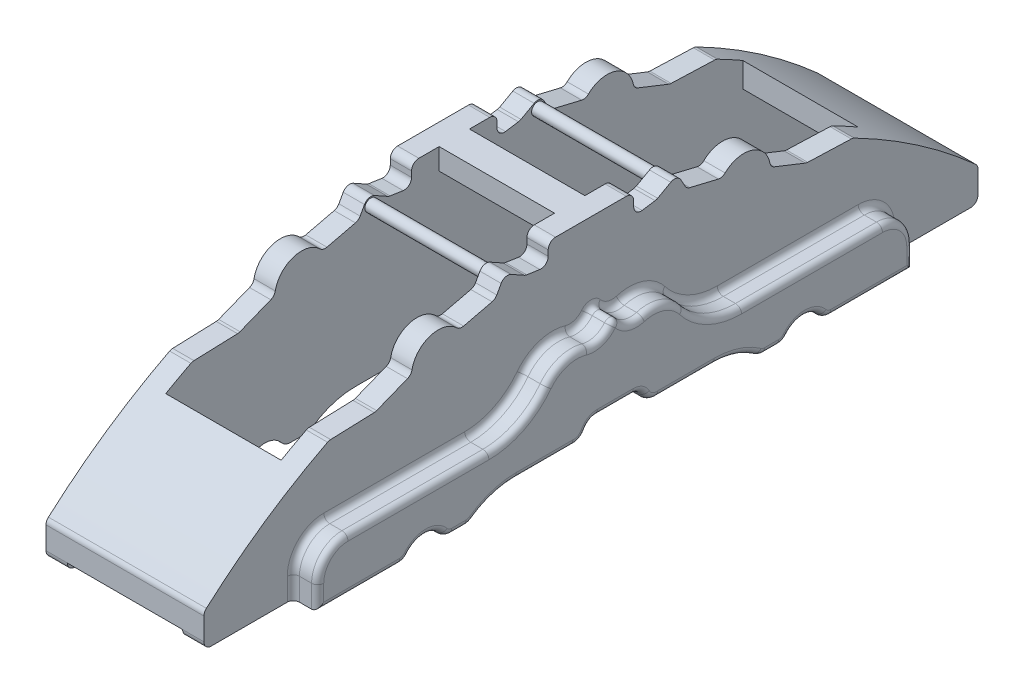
SolidWorks part; units mm, degrees
ref_plane "Front Plane" through (0, 0, 0) normal (0, 0, 1) x (1, 0, 0)
ref_plane "Top Plane" through (0, 0, 0) normal (0, 1, 0) x (1, 0, 0)
ref_plane "Right Plane" through (0, 0, 0) normal (1, 0, 0) x (0, 0, -1)
sketch "Sketch1" plane through (0, 0, 0) normal (1, 0, 0) x (0, 0, -1)
  line L0 (-95, 0) -> (-87.27, 0) construction
  line L1 (0, 166.0361) -> (0, 65.0331) construction
  line L2 (-63.7215, 65.0331) -> (58.1957, 65.0331) construction
  line L3 (0, -87.27) -> (0, -214.068) construction
  line L4 (2.939, 70.0131) -> (-2.939, 70.0131)
  line L5 (-7.0401, 67.674) -> (-16.2966, 67.674)
  line L6 (-24.5815, 65.0331) -> (-26.9166, 65.0331)
  line L7 (-35.4808, 65.0331) -> (-54.9446, 65.0331)
  line L8 (-58.1957, 65.0331) -> (-62.514, 65.0331)
  line L9 (-63.7215, 66.2407) -> (-63.7215, 69.9215)
  line L10 (-58.1957, 65.0331) -> (-57.3597, 65.0331)
  line L11 (58.1957, 65.0331) -> (57.3597, 65.0331)
  line L12 (35.4808, 65.0331) -> (58.1957, 65.0331)
  line L13 (24.5815, 65.0331) -> (26.9166, 65.0331)
  line L14 (7.0401, 67.674) -> (16.2966, 67.674)
  line L15 (5.8325, 95) -> (-5.8325, 95)
  line L16 (-7.0401, 93.7924) -> (-7.0401, 92.8759)
  line L17 (-8.4245, 91.6813) -> (-10.5682, 91.9985)
  line L18 (-10.9799, 92.1386) -> (-13.1413, 93.3449)
  line L19 (-14.7842, 92.8789) -> (-15.5027, 91.5916)
  line L20 (-16.2768, 91.0055) -> (-20.9626, 89.8872)
  line L21 (-30.2095, 87.0105) -> (-35.2872, 84.998)
  line L22 (-35.6889, 84.9139) -> (-42.8583, 84.6567)
  line L23 (63.7215, 66.2407) -> (63.7215, 69.9215)
  line L25 (35.6889, 84.9139) -> (42.8583, 84.6567)
  line L26 (30.2095, 87.0105) -> (35.2872, 84.998)
  line L27 (16.2768, 91.0055) -> (20.9626, 89.8872)
  line L28 (8.4245, 91.6813) -> (10.5682, 91.9985)
  line L29 (14.7842, 92.8789) -> (15.5027, 91.5916)
  line L30 (10.9799, 92.1386) -> (13.1413, 93.3449)
  line L31 (7.0401, 93.7924) -> (7.0401, 92.8759)
  line L34 (-57.3597, 65.0331) -> (-54.9446, 65.0331)
  line L35 (58.1957, 65.0331) -> (62.514, 65.0331)
  arc A1 (55.7155, 67.1702) -> (-55.7155, 67.1702) centre (0, 0) ccw construction
  arc A2 (-4.7152, 68.9324) -> (-7.0401, 67.674) centre (-6.8031, 70.0131) cw
  arc A3 (-16.2966, 67.674) -> (-23.4241, 65.4021) centre (-16.2966, 55.3578) ccw
  arc A4 (-28.4685, 65.7715) -> (-33.9289, 65.7715) centre (-31.1987, 63.5521) ccw
  arc A5 (-35.4808, 65.0331) -> (-33.9289, 65.7715) centre (-35.4808, 67.0331) ccw
  arc A6 (-26.9166, 65.0331) -> (-28.4685, 65.7715) centre (-26.9166, 67.0331) cw
  arc A7 (-23.4241, 65.4021) -> (-24.5815, 65.0331) centre (-24.5815, 67.0331) cw
  arc A8 (-4.7152, 68.9324) -> (-2.939, 70.0131) centre (-2.939, 68.0131) cw
  arc A9 (4.7152, 68.9324) -> (2.939, 70.0131) centre (2.939, 68.0131) ccw
  arc A10 (23.4241, 65.4021) -> (24.5815, 65.0331) centre (24.5815, 67.0331) ccw
  arc A11 (26.9166, 65.0331) -> (28.4685, 65.7715) centre (26.9166, 67.0331) ccw
  arc A12 (35.4808, 65.0331) -> (33.9289, 65.7715) centre (35.4808, 67.0331) cw
  arc A13 (28.4685, 65.7715) -> (33.9289, 65.7715) centre (31.1987, 63.5521) cw
  arc A14 (16.2966, 67.674) -> (23.4241, 65.4021) centre (16.2966, 55.3578) cw
  arc A15 (4.7152, 68.9324) -> (7.0401, 67.674) centre (6.8031, 70.0131) ccw
  arc A16 (-22.0839, 90.1952) -> (-29.4703, 87.8967) centre (-25.1511, 87.0344) ccw
  arc A17 (-43.3663, 84.5243) -> (-63.3188, 70.8218) centre (0, 0) ccw
  arc A19 (-62.514, 65.0331) -> (-63.7215, 66.2407) centre (-62.514, 66.2407) cw
  arc A20 (-63.7215, 69.9215) -> (-63.3188, 70.8218) centre (-62.514, 69.9215) cw
  arc A21 (-42.8583, 84.6567) -> (-43.3663, 84.5243) centre (-42.8151, 83.4499) ccw
  arc A22 (-35.2872, 84.998) -> (-35.6889, 84.9139) centre (-35.7322, 86.1207) cw
  arc A23 (-29.4703, 87.8967) -> (-30.2095, 87.0105) centre (-30.6545, 88.1331) cw
  arc A24 (-20.9626, 89.8872) -> (-22.0839, 90.1952) centre (-21.2429, 91.0618) cw
  arc A25 (-15.5027, 91.5916) -> (-16.2768, 91.0055) centre (-16.5572, 92.1801) cw
  arc A26 (-13.1413, 93.3449) -> (-14.7842, 92.8789) centre (-13.7298, 92.2904) ccw
  arc A27 (-10.5682, 91.9985) -> (-10.9799, 92.1386) centre (-10.3914, 93.1931) cw
  arc A28 (-7.0401, 92.8759) -> (-8.4245, 91.6813) centre (-8.2477, 92.8759) cw
  arc A29 (-5.8325, 95) -> (-7.0401, 93.7924) centre (-5.8325, 93.7924) ccw
  arc A32 (63.7215, 69.9215) -> (63.3188, 70.8218) centre (62.514, 69.9215) ccw
  arc A33 (62.514, 65.0331) -> (63.7215, 66.2407) centre (62.514, 66.2407) ccw
  arc A35 (35.2872, 84.998) -> (35.6889, 84.9139) centre (35.7322, 86.1207) ccw
  arc A36 (42.8583, 84.6567) -> (43.3663, 84.5243) centre (42.8151, 83.4499) cw
  arc A37 (43.3663, 84.5243) -> (63.3188, 70.8218) centre (0, 0) cw
  arc A38 (29.4703, 87.8967) -> (30.2095, 87.0105) centre (30.6545, 88.1331) ccw
  arc A39 (20.9626, 89.8872) -> (22.0839, 90.1952) centre (21.2429, 91.0618) ccw
  arc A40 (22.0839, 90.1952) -> (29.4703, 87.8967) centre (25.1511, 87.0344) cw
  arc A41 (15.5027, 91.5916) -> (16.2768, 91.0055) centre (16.5572, 92.1801) ccw
  arc A42 (5.8325, 95) -> (7.0401, 93.7924) centre (5.8325, 93.7924) cw
  arc A43 (7.0401, 92.8759) -> (8.4245, 91.6813) centre (8.2477, 92.8759) ccw
  arc A44 (10.5682, 91.9985) -> (10.9799, 92.1386) centre (10.3914, 93.1931) ccw
  arc A45 (13.1413, 93.3449) -> (14.7842, 92.8789) centre (13.7298, 92.2904) cw
  point P9 (23.9174, 65.0331)
  point P24 (-34.3903, 65.0331)
  point P27 (-28.0071, 65.0331)
  point P30 (-23.9174, 65.0331)
  point P54 (0, 70.0131)
  point P55 (28.0071, 65.0331)
  point P56 (34.3903, 65.0331)
  point P74 (-63.7215, 70.4597)
  point P77 (-43.1262, 84.6471)
  point P106 (63.7215, 70.4597)
  point P113 (43.1262, 84.6471)
  point P136 (0, 95)
  dimension "D2" = 87.27
  dimension "D4" = 2
  dimension "D3" = 65.0331
extrude "Boss-Extrude1" add sketch "Sketch1" along normal blind 26 contours A45 L30 A44 L28 A43 L31 A42 L15 A29 L16 A28 L17 A27 L18 A26 L19 A25 L20 A24 A16 A23 L21 A22 L22 A21 A17 A20 L9 A19 L8 L10 L34 L7 A5 A4 A6 L6 A7 A3 L5 A2 A8 L4 A9 A15 L14 A14 A10 L13 A11 A13
shell "Shell1" thickness 3.5
sketch "Sketch2" plane through (0, 0, 0) normal (0, 1, 0) x (1, 0, 0)
  line L0 (26, 0) -> (108.635, 0) construction
  line L1 (13, 63.7215) -> (13, 2.5) construction
  line L2 (26, 63.7215) -> (0, 63.7215) construction
  line L3 (26, -63.3188) -> (0, -63.3188) construction
  line L4 (26, 5.8325) -> (26, -5.8325) construction
  line L5 (3.5, 2.5) -> (22.5, 2.5)
  line L6 (0, 2.5) -> (0, -2.5)
  line L7 (3.5, -2.5) -> (22.5, -2.5)
  line L8 (26, 2.5) -> (26, -2.5)
  line L9 (13, -2.5) -> (13, -63.3188) construction
  line L11 (22.5, -2.5) -> (22.5, -47.5)
  line L13 (3.5, 2.5) -> (3.5, 47.5)
  line L14 (3.5, 47.5) -> (22.5, 47.5)
  line L15 (22.5, 2.5) -> (22.5, 47.5)
  line L16 (3.5, -2.5) -> (3.5, -47.5)
  line L17 (3.5, -47.5) -> (22.5, -47.5)
  point P9 (13, 0)
  dimension "D1" = 5
  dimension "D2" = 45
  dimension "D3" = 19
extrude "Cut-Extrude1" cut sketch "Sketch2" along normal through all contours L5 L15 L14 L13 | L16 L17 L11 L7
sketch "Sketch3" plane through (26, 0, 0) normal (1, 0, 0) x (0, 0, -1)
  line L0 (-48.9974, 65.0331) -> (-48.9974, 68.7336)
  line L1 (-35.4808, 65.0331) -> (-62.514, 65.0331) construction
  line L2 (-43.9974, 73.7336) -> (-20.7937, 73.7336)
  line L3 (0, 70.0131) -> (0, 100.2118) construction
  line L4 (2.939, 70.0131) -> (-2.939, 70.0131) construction
  line L5 (43.9974, 73.7336) -> (20.7937, 73.7336)
  line L6 (48.9974, 65.0331) -> (48.9974, 68.7336)
  line L7 (35.4808, 65.0331) -> (62.514, 65.0331) construction
  line L8 (24.5815, 65.0331) -> (26.9166, 65.0331) construction
  line L9 (7.0401, 67.674) -> (16.2966, 67.674) construction
  line L10 (-7.0401, 67.674) -> (-16.2966, 67.674) construction
  line L11 (-24.5815, 65.0331) -> (-26.9166, 65.0331) construction
  line L12 (35.4808, 65.0331) -> (48.9974, 65.0331)
  line L13 (24.5815, 65.0331) -> (26.9166, 65.0331)
  line L14 (7.0401, 67.674) -> (16.2966, 67.674)
  line L15 (2.939, 70.0131) -> (-2.939, 70.0131)
  line L16 (-7.0401, 67.674) -> (-16.2966, 67.674)
  line L17 (-24.5815, 65.0331) -> (-26.9166, 65.0331)
  line L18 (-35.4808, 65.0331) -> (-48.9974, 65.0331)
  arc A0 (-20.7937, 73.7336) -> (-11.3692, 78.371) centre (-20.7937, 85.6288) ccw
  arc A1 (-11.3692, 78.371) -> (-4.4878, 80.6149) centre (-6.2862, 74.4567) cw
  arc A2 (-4.4878, 80.6149) -> (0, 83.8451) centre (-3.5047, 83.9817) ccw
  arc A3 (-48.9974, 68.7336) -> (-43.9974, 73.7336) centre (-43.9974, 68.7336) cw
  arc A4 (4.4878, 80.6149) -> (0, 83.8451) centre (3.5047, 83.9817) cw
  arc A5 (11.3692, 78.371) -> (4.4878, 80.6149) centre (6.2862, 74.4567) ccw
  arc A6 (20.7937, 73.7336) -> (11.3692, 78.371) centre (20.7937, 85.6288) cw
  arc A7 (48.9974, 68.7336) -> (43.9974, 73.7336) centre (43.9974, 68.7336) ccw
  arc A8 (33.9289, 65.7715) -> (35.4808, 65.0331) centre (35.4808, 67.0331) ccw construction
  arc A9 (33.9289, 65.7715) -> (28.4685, 65.7715) centre (31.1987, 63.5521) ccw construction
  arc A10 (26.9166, 65.0331) -> (28.4685, 65.7715) centre (26.9166, 67.0331) ccw construction
  arc A11 (23.4241, 65.4021) -> (24.5815, 65.0331) centre (24.5815, 67.0331) ccw construction
  arc A12 (23.4241, 65.4021) -> (16.2966, 67.674) centre (16.2966, 55.3578) ccw construction
  arc A13 (4.7152, 68.9324) -> (7.0401, 67.674) centre (6.8031, 70.0131) ccw construction
  arc A14 (4.7152, 68.9324) -> (2.939, 70.0131) centre (2.939, 68.0131) ccw construction
  arc A15 (-2.939, 70.0131) -> (-4.7152, 68.9324) centre (-2.939, 68.0131) ccw construction
  arc A16 (-7.0401, 67.674) -> (-4.7152, 68.9324) centre (-6.8031, 70.0131) ccw construction
  arc A17 (-24.5815, 65.0331) -> (-23.4241, 65.4021) centre (-24.5815, 67.0331) ccw construction
  arc A18 (-16.2966, 67.674) -> (-23.4241, 65.4021) centre (-16.2966, 55.3578) ccw construction
  arc A19 (-28.4685, 65.7715) -> (-26.9166, 65.0331) centre (-26.9166, 67.0331) ccw construction
  arc A20 (-35.4808, 65.0331) -> (-33.9289, 65.7715) centre (-35.4808, 67.0331) ccw construction
  arc A21 (-28.4685, 65.7715) -> (-33.9289, 65.7715) centre (-31.1987, 63.5521) ccw construction
  arc A22 (33.9289, 65.7715) -> (35.4808, 65.0331) centre (35.4808, 67.0331) ccw
  arc A23 (33.9289, 65.7715) -> (28.4685, 65.7715) centre (31.1987, 63.5521) ccw
  arc A24 (26.9166, 65.0331) -> (28.4685, 65.7715) centre (26.9166, 67.0331) ccw
  arc A25 (23.4241, 65.4021) -> (24.5815, 65.0331) centre (24.5815, 67.0331) ccw
  arc A26 (23.4241, 65.4021) -> (16.2966, 67.674) centre (16.2966, 55.3578) ccw
  arc A27 (4.7152, 68.9324) -> (7.0401, 67.674) centre (6.8031, 70.0131) ccw
  arc A28 (4.7152, 68.9324) -> (2.939, 70.0131) centre (2.939, 68.0131) ccw
  arc A29 (-2.939, 70.0131) -> (-4.7152, 68.9324) centre (-2.939, 68.0131) ccw
  arc A30 (-7.0401, 67.674) -> (-4.7152, 68.9324) centre (-6.8031, 70.0131) ccw
  arc A31 (-24.5815, 65.0331) -> (-23.4241, 65.4021) centre (-24.5815, 67.0331) ccw
  arc A32 (-16.2966, 67.674) -> (-23.4241, 65.4021) centre (-16.2966, 55.3578) ccw
  arc A33 (-28.4685, 65.7715) -> (-26.9166, 65.0331) centre (-26.9166, 67.0331) ccw
  arc A34 (-35.4808, 65.0331) -> (-33.9289, 65.7715) centre (-35.4808, 67.0331) ccw
  arc A35 (-28.4685, 65.7715) -> (-33.9289, 65.7715) centre (-31.1987, 63.5521) ccw
  dimension "D1" = 5
extrude "Boss-Extrude2" add sketch "Sketch3" along normal blind 4
fillet "Fillet1" radius 1 33 edges at (30, 66.8834, 48.9974) (30, 72.2691, 47.5329) (30, 73.7336, 32.3955) (30, 74.9557, 15.5418) (30, 80.5561, 8.2752) (30, 81.135, 1.4558) (30, 81.135, -1.4558) (30, 80.5561, -8.2752) (30, 74.9557, -15.5418) (30, 73.7336, -32.3955) (30, 72.2691, -47.5329) (30, 66.8834, -48.9974) (30, 65.0331, -42.2391) (30, 65.2272, -34.6215) (30, 67.0706, -31.1987) (30, 65.2272, -27.7759) (30, 65.0331, -25.7491) (30, 65.1276, -23.9741) (30, 67.0923, -20.037) (30, 67.674, -11.6683) (30, 67.9455, -5.684) (30, 69.7217, -3.9786) (30, 70.0131, 0) (30, 69.7217, 3.9786) (30, 67.9455, 5.684) (30, 67.674, 11.6683) (30, 67.0923, 20.037) (30, 65.1276, 23.9741) (30, 65.0331, 25.7491) (30, 65.2272, 27.7759) (30, 67.0706, 31.1987) (30, 65.2272, 34.6215) (30, 65.0331, 42.2391)
fillet "Fillet3" radius 1 2 edges at (29.0883, 83.7671, 0) (27.5, 83.8451, 0)
fillet "Fillet4" radius 1 13 edges at (26, 66.8834, -48.9974) (26, 72.2691, -47.5329) (26, 73.7336, -32.3955) (26, 74.9557, -15.5418) (26, 80.5561, -8.2752) (26, 80.6344, -2.4571) (26, 82.1473, 0) (26, 80.6344, 2.4571) (26, 80.5561, 8.2752) (26, 66.8834, 48.9974) (26, 72.2691, 47.5329) (26, 73.7336, 32.3955) (26, 74.9557, 15.5418)
sketch "Sketch4" plane through (0, 65.0331, 0) normal (0, -1, 0) x (1, 0, 0)
  line L0 (0, 0) -> (124.1865, 0) construction
  line L1 (24.0989, -18.0042) -> (27.7771, -18.0042)
  line L2 (24.0989, 45.4944) -> (27.7771, 45.4944)
  line L3 (24.0989, 45.4944) -> (24.0989, 18.0042)
  line L4 (24.0989, 18.0042) -> (27.7771, 18.0042)
  line L5 (27.7771, 45.4944) -> (27.7771, 18.0042)
  line L6 (27.7771, -45.4944) -> (27.7771, -18.0042)
  line L7 (24.0989, -45.4944) -> (27.7771, -45.4944)
  line L8 (24.0989, -45.4944) -> (24.0989, -18.0042)
extrude "Cut-Extrude2" cut sketch "Sketch4" against normal blind 6
sketch "Sketch5" plane through (26, 0, 0) normal (1, 0, 0) x (0, 0, -1)
  line L0 (0, 70.0131) -> (0, 119.1089) construction
  line L1 (2.939, 70.0131) -> (-2.939, 70.0131) construction
  circle A0 centre (-13.7298, 92.2904) radius 1
  circle A1 centre (13.7298, 92.2904) radius 1
  dimension "D1" = 2
extrude "Cut-Extrude3" cut sketch "Sketch5" against normal through all and the other way through all
ref_plane "Plane1" through (13, 0, 0) normal (1, 0, 0) x (0, 0, -1)
ref_plane "Plane2" through (0, 0, 0) normal (0, 0, 1) x (1, 0, 0)
sketch "Sketch6" plane through (26, 0, 0) normal (1, 0, 0) x (0, 0, -1)
  circle A0 centre (-13.7298, 92.2904) radius 1 construction
  circle A1 centre (-13.7298, 92.2904) radius 1
  circle A2 centre (13.7298, 92.2904) radius 1 construction
  circle A3 centre (13.7298, 92.2904) radius 1
extrude "Boss-Extrude3" add sketch "Sketch6" against normal blind 26
